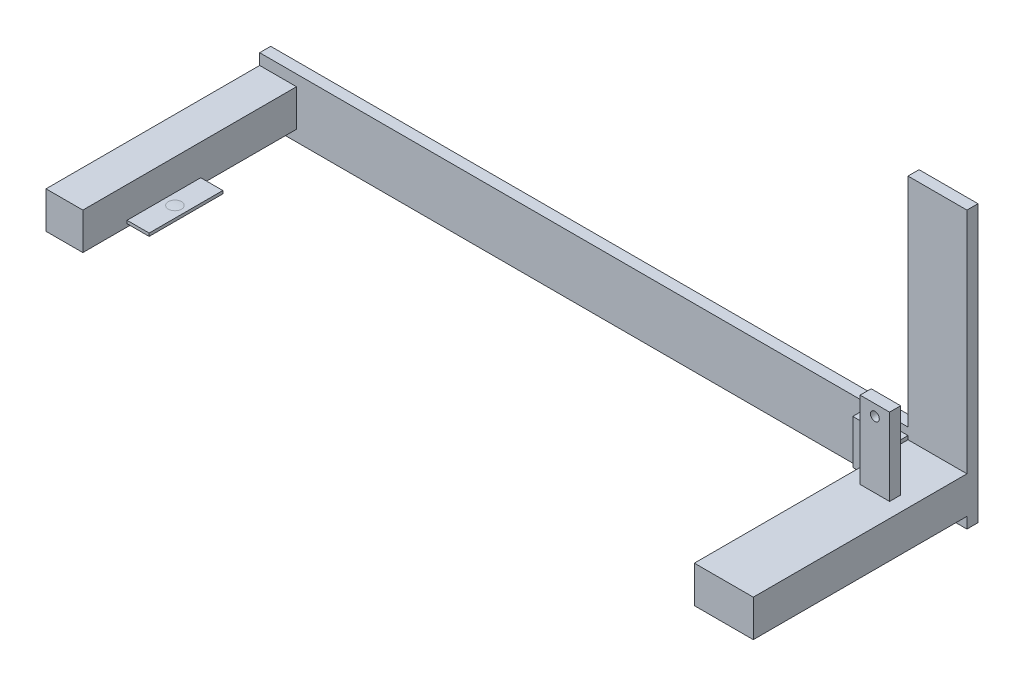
SolidWorks part; units mm, degrees
ref_plane "Plan1" through (0, 0, 0) normal (0, 0, 1) x (1, 0, 0)
ref_plane "Plan2" through (0, 0, 0) normal (0, 1, 0) x (1, 0, 0)
ref_plane "Plan3" through (0, 0, 0) normal (1, 0, 0) x (0, 0, -1)
sketch "Esquisse1" plane through (0, 0, 0) normal (0, 0, 1) x (1, 0, 0)
  line L0 (70, 10) -> (70, 305)
  line L1 (-810, 10) -> (70, 10)
  line L2 (-810, 10) -> (-810, -70)
  line L3 (-810, -70) -> (150, -70)
  line L4 (150, 305) -> (150, -70)
  line L5 (70, 305) -> (150, 305)
  dimension "D1" = 80
  dimension "D2" = 80
  dimension "D3" = 375
  dimension "D4" = 960
extrude "Base-Extrusion" add sketch "Esquisse1" along normal blind 15
sketch "Esquisse2" plane through (0, 0, 15) normal (0, 0, 1) x (1, 0, 0)
  line L0 (-810, 10) -> (-810, -70) construction
  line L1 (-810, -5) -> (-760, -5)
  line L2 (-810, -5) -> (-810, -55)
  line L3 (-810, -55) -> (-760, -55)
  line L4 (-760, -5) -> (-760, -55)
  dimension "D1" = 15
  dimension "D2" = 15
  dimension "D3" = 50
extrude "Boss.-Extru.1" add sketch "Esquisse2" along normal blind 290
sketch "Esquisse3" plane through (0, 0, 15) normal (0, 0, 1) x (1, 0, 0)
  line L0 (150, -70) -> (150, 305) construction
  line L1 (150, -5) -> (70, -5)
  line L2 (150, -5) -> (150, -55)
  line L3 (150, -55) -> (70, -55)
  line L4 (70, -5) -> (70, -55)
  dimension "D1" = 80
  dimension "D2" = 15
  dimension "D3" = 15
extrude "Boss.-Extru.2" add sketch "Esquisse3" along normal blind 290
sketch "Esquisse4" plane through (0, 0, 15) normal (0, 0, 1) x (1, 0, 0)
  line L1 (70, 0) -> (10, 0)
  line L2 (70, 0) -> (70, -60)
  line L3 (70, -60) -> (10, -60)
  line L4 (10, 0) -> (10, -60)
  circle A0 centre (40, -30) radius 10
  dimension "D5" = 20
  dimension "D1" = 5
  dimension "D2" = 5
  dimension "D3" = 60
  dimension "D4" = 60
  dimension "D6" = 30
  dimension "D7" = 30
extrude "Boss.-Extru.3" add sketch "Esquisse4" along normal blind 15
sketch "Esquisse5" plane through (0, -5, 0) normal (0, 1, 0) x (-1, 0, 0)
  line L1 (-130, 100) -> (-90, 100)
  line L2 (-130, 100) -> (-130, 85)
  line L3 (-130, 85) -> (-90, 85)
  line L4 (-90, 100) -> (-90, 85)
  dimension "D1" = 40
  dimension "D2" = 15
  dimension "D3" = 70
  dimension "D4" = 20
extrude "Boss.-Extru.4" add sketch "Esquisse5" along normal blind 105
sketch "Esquisse6" plane through (0, 0, 100) normal (0, 0, 1) x (1, 0, 0)
  circle A0 centre (110, 85) radius 6
  dimension "D1" = 12
  dimension "D2" = 20
  dimension "D3" = 15
extrude "Enlèv. mat.-Extru.1" cut sketch "Esquisse6" against normal up to next
sketch "Esquisse7" plane through (-760, 0, 0) normal (1, 0, 0) x (0, 0, -1)
  line L1 (-245, -51) -> (-145, -51)
  line L2 (-245, -51) -> (-245, -47)
  line L3 (-245, -47) -> (-145, -47)
  line L4 (-145, -51) -> (-145, -47)
  dimension "D1" = 100
  dimension "D2" = 4
  dimension "D3" = 60
  dimension "D4" = 4
extrude "Boss.-Extru.5" add sketch "Esquisse7" along normal blind 30
sketch "Esquisse9" plane through (70, 0, 0) normal (-1, 0, 0) x (0, 0, 1)
  circle A0 centre (277.5, -30) radius 12.5
  dimension "D3" = 25
  dimension "D1" = 25
  dimension "D2" = 27.5
extrude "Boss.-Extru.7" add sketch "Esquisse9" along normal blind 5
sketch "Esquisse12" plane through (65, 0, 0) normal (-1, 0, 0) x (0, 0, 1)
  circle A0 centre (277.5, -30) radius 6
  circle A1 centre (277.5, -30) radius 12.5 construction
  dimension "D1" = 12
extrude "Enlèv. mat.-Extru.2" cut sketch "Esquisse12" against normal blind 30
ref_plane "Plan4" through (-745, 0, 0) normal (1, 0, 0) x (0, 0, -1)
sketch "Esquisse13" plane through (-745, 0, 0) normal (1, 0, 0) x (0, 0, -1)
  line L0 (-195, -46.6) -> (-195, -47)
  line L1 (-195, -47) -> (-186.0647, -47)
  line L2 (-145, -47) -> (-245, -47) construction
  line L3 (-195, -46.6) -> (-195, -59.0402) construction
  arc A0 (-186.0647, -47) -> (-195, -46.6) centre (-195, -146.6) ccw
  dimension "D1" = 100
  dimension "D2" = 0.4
revolve "Révolution1" add sketch "Esquisse13" angle 360 about L3
